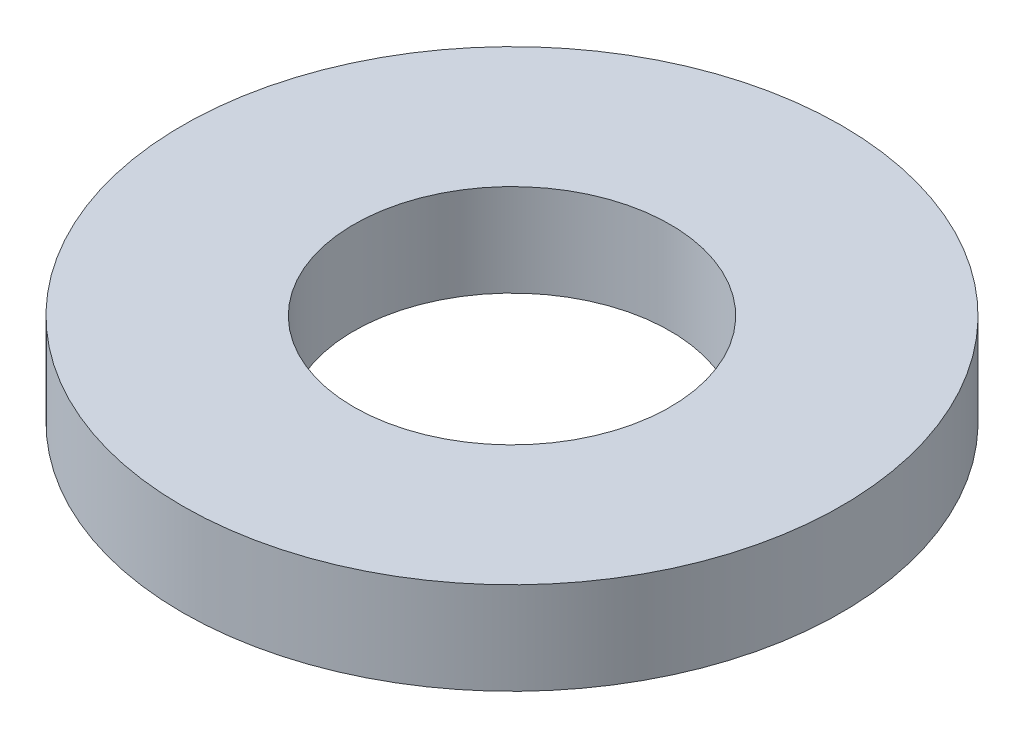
SolidWorks part; units mm, degrees
ref_plane "Front Plane" through (0, 0, 0) normal (0, 0, 1) x (1, 0, 0)
ref_plane "Top Plane" through (0, 0, 0) normal (0, 1, 0) x (1, 0, 0)
ref_plane "Right Plane" through (0, 0, 0) normal (1, 0, 0) x (0, 0, -1)
sketch "Sketch1" plane through (0, 0, 0) normal (0, 1, 0) x (1, 0, 0)
  circle A0 centre (0, 0) radius 1.524
  circle A1 centre (0, 0) radius 3.175
  dimension "D1" = 3.048
  dimension "D2" = 6.35
extrude "Extrude1" add sketch "Sketch1" along normal blind 0.889
